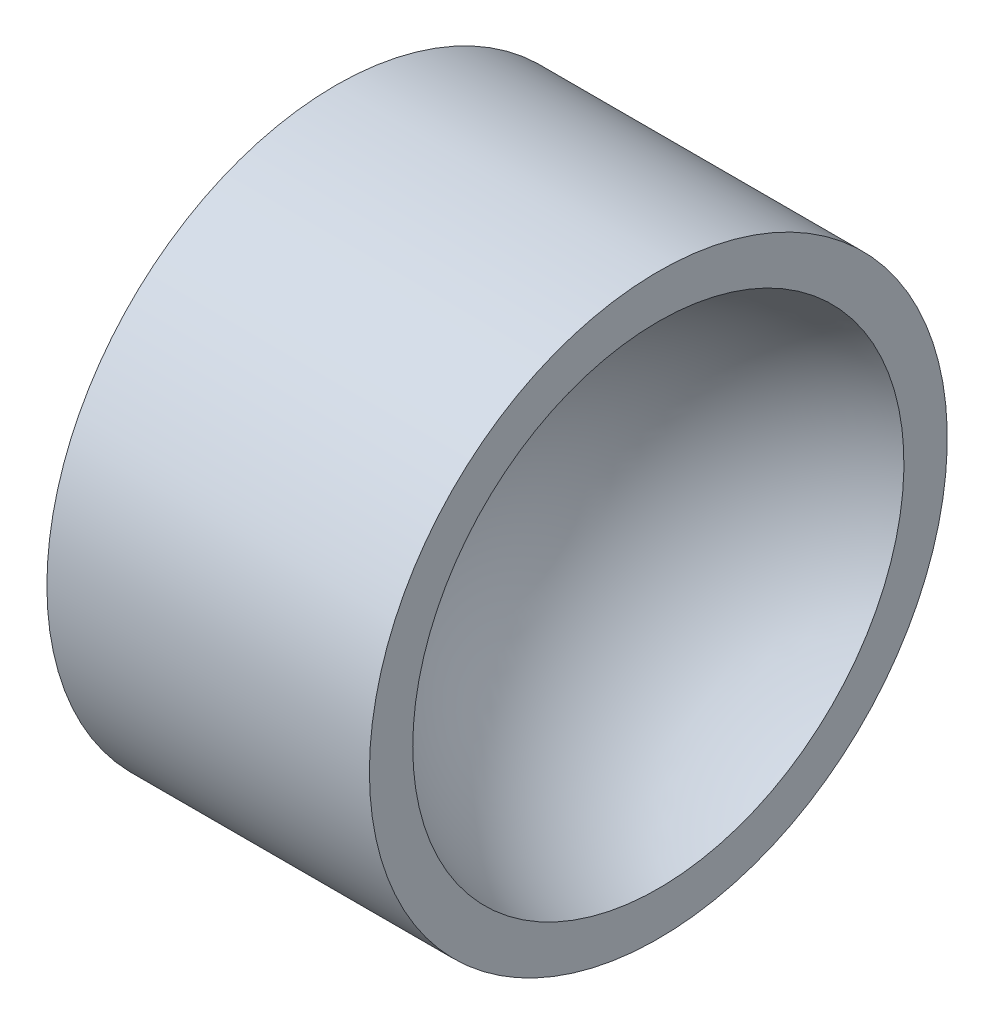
SolidWorks part; units mm, degrees
ref_plane "Vorne" through (0, 0, 0) normal (0, 0, 1) x (1, 0, 0)
ref_plane "Oben" through (0, 0, 0) normal (0, 1, 0) x (1, 0, 0)
ref_plane "Rechts" through (0, 0, 0) normal (1, 0, 0) x (0, 0, -1)
sketch "Skizze1" plane through (0, 0, 0) normal (0, 0, 1) x (1, 0, 0)
  line L2 (0, 0) -> (79.1682, 0) construction
  line L4 (50.695, 0) -> (52.295, 0)
  line L8 (53.5443, 2) -> (51.312, 2) construction
  line L9 (53.5443, 1.7) -> (53.5443, 2) construction
  line L10 (53.5443, 2) -> (51.312, 2)
  line L11 (53.5443, 1.7) -> (53.5443, 2)
  arc A4 (51.312, 2) -> (50.695, 0) centre (54.245, 0) ccw construction
  arc A5 (53.5443, 1.7) -> (52.295, 0) centre (54.0763, 0) ccw construction
  arc A6 (51.312, 2) -> (50.695, 0) centre (54.245, 0) ccw
  arc A7 (53.5443, 1.7) -> (52.295, 0) centre (54.0763, 0) ccw
revolve "Rotation2" add sketch "Skizze1" angle 360 about L4
